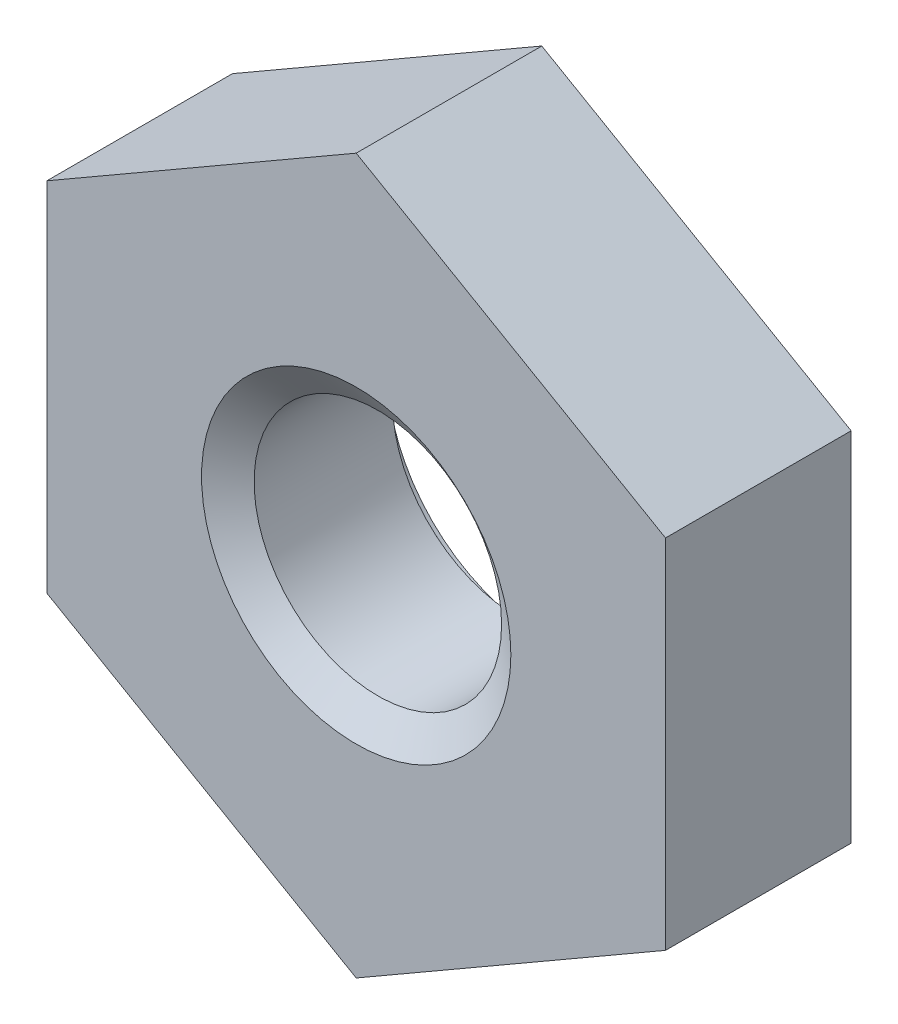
SolidWorks part; units mm, degrees
ref_plane "Plane1" through (0, 0, 0) normal (0, 0, 1) x (1, 0, 0)
ref_plane "Plane2" through (0, 0, 0) normal (0, 1, 0) x (1, 0, 0)
ref_plane "Plane3" through (0, 0, 0) normal (1, 0, 0) x (0, 0, -1)
revolve "EndChamfer" cut sketch "Sketch5"
sketch "Sketch5"
  line L0 (1.1746, 1) -> (1.0206, 0.78)
  line L1 (1.2254, 1) -> (1.1746, 1)
  line L2 (1.2254, 1) -> (1.2254, 0.78)
  line L3 (1.2254, 0.78) -> (1.0206, 0.78)
  line L6 (-0.0508, 1) -> (0, 1)
  line L7 (0, 1) -> (0.154, 0.78)
  line L9 (0.154, 0.78) -> (-0.0508, 0.78)
  line L10 (-0.0508, 0.78) -> (-0.0508, 1)
  line L11 (25.0375, 0) -> (38.388, 0) construction
  line L12 (1.2, 0) -> (0, 0) construction
extrude "BaseNut" add sketch "BaseNutSke" against normal blind 1.2
sketch "BaseNutSke" plane through (0, 0, 0) normal (0, 0, 1) x (1, 0, 0)
  line L6 (2, 1.1547) -> (2, -1.1547)
  line L7 (-2, 1.1547) -> (-2, -1.1547)
  line L8 (2, 1.1547) -> (0, 2.3094)
  line L9 (0, 2.3094) -> (-2, 1.1547)
  line L10 (-2, -1.1547) -> (0, -2.3094)
  line L11 (0, -2.3094) -> (2, -1.1547)
  circle A0 centre (0, 0) radius 0.8
  dimension "D4" = 2
  dimension "Tap_drill" = 1.6
  dimension "D1" = 120
  dimension "D2" = 2
  dimension "D3" = 2
  dimension "Width_flats" = 4
pattern_linear "ThdSchPat" [suppressed]
revolve "ThreadSchematic" cut sketch "ThdSchSke" angle 360 about L11
sketch "ThdSchSke" plane through (0, 0, 0) normal (0, 1, 0) x (1, 0, 0)
  line L0 (-1, 0.0254) -> (-0.8, 0.1654)
  line L1 (-0.8, 0.1654) -> (-0.4, 0.1654)
  line L2 (-0.4, 0.1654) -> (-0.4, -0.1146)
  line L3 (-0.4, -0.1146) -> (-0.8, -0.1146)
  line L4 (-0.8, -0.1146) -> (-1, 0.0254)
  line L5 (-3.175, 0.4) -> (3.175, 0.4) construction
  line L6 (0, 0.4) -> (0, -2.9874) construction
  line L7 (0, 1.0346) -> (0, 0.14) construction
  dimension "D1" = 35
  dimension "VeeAngle" = 70
  dimension "SideAngle" = 55
  dimension "D2" = 0.0508
  dimension "OverCut" = 0.8
  dimension "Tap_Drill" = 1.6
  dimension "Advance" = 0.3831
  dimension "Thread_major" = 2
  dimension "Num_threads" = 4
  dimension "D4" = 50
  dimension "Offset1" = 1.2254
  dimension "ThreadMajor" = 1
  dimension "ChamferDepth" = 0.22
  dimension "Offset2" = 1.2762
equation "\"D2@BaseNutSke\" = \"Width_flats@BaseNutSke\" / 2"
equation "\"D3@BaseNutSke\" = \"Width_flats@BaseNutSke\" / 2"
equation "\"D4@BaseNutSke\" = \"D3@BaseNutSke\""
equation "\"Thread_major@ThdSchSke\" = \"Thread_major@ThreadCosmetic\""
equation "\"Tap_drill@ThdSchSke\" = \"Tap_drill@BaseNutSke\""
equation "\"Overcut@ThdSchSke\" = \"Tap_drill@ThdSchSke\" * 0.5"
equation "\"Num_threads@ThdSchPat\" = int(  ( \"Thickness@BaseNut\" - 0.0508 ) / \"Advance@ThdSchSke\" + 0.999 )  + 1"
equation "\"Advance@ThdSchPat\" = ( \"Thickness@BaseNut\" - 0.0508 ) /  (\"Num_threads@ThdSchPat\" - 1) 'relax it"
equation "' \"Num_threads@ThdSchPat\" = \"Num_threads@ThdSchPat\" - sgn( \"Num_threads@ThdSchPat\" - 1) '---chamfered tips only---"
equation "\"ThreadMajor@Sketch5\" = \"Thread_major@ThreadCosmetic\" * 0.5"
equation "\"ChamferDepth@Sketch5\" = (\"Thread_major@ThreadCosmetic\" - \"Tap_drill@BaseNutSke\") * 0.55"
equation "\"Offset1@Sketch5\" = \"Thickness@BaseNut\" + 0.0254"
equation "\"Offset2@Sketch5\" = \"Offset1@Sketch5\" + 0.0508"
